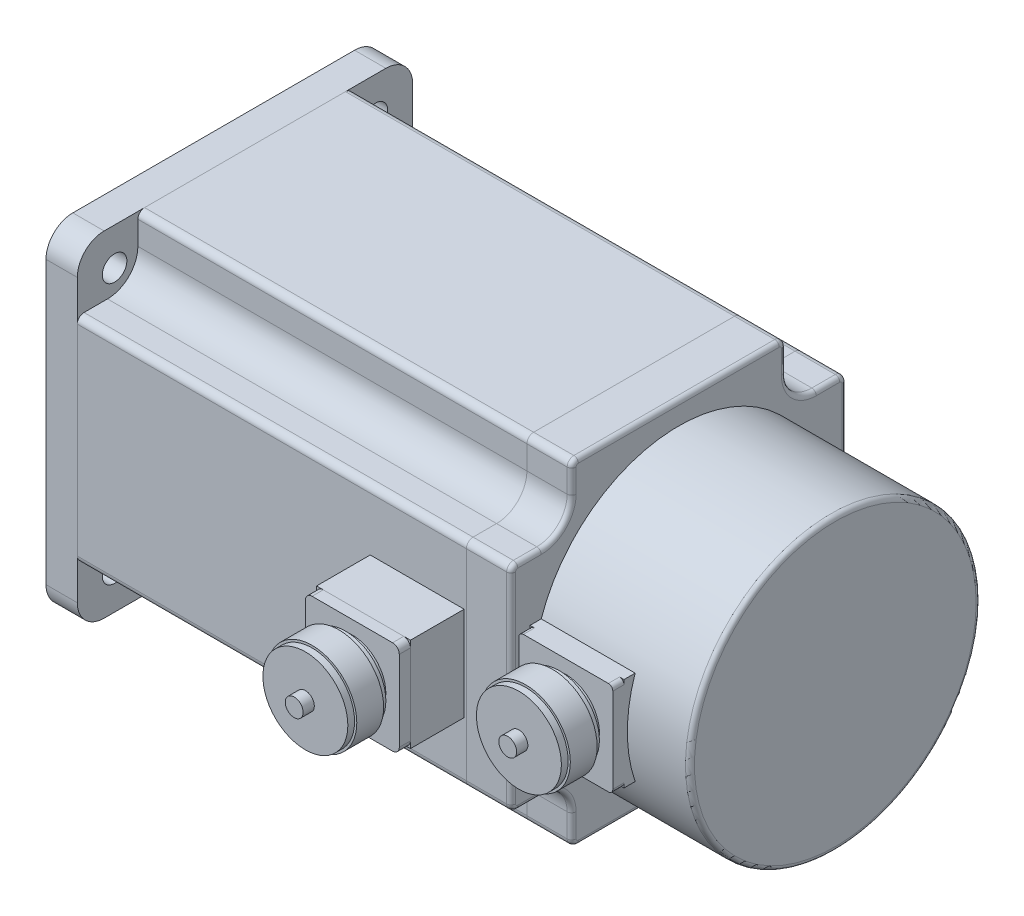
SolidWorks part; units mm, degrees
ref_plane "前视基准面" through (0, 0, 0) normal (0, 0, 1) x (1, 0, 0)
ref_plane "上视基准面" through (0, 0, 0) normal (0, 1, 0) x (1, 0, 0)
ref_plane "右视基准面" through (0, 0, 0) normal (1, 0, 0) x (0, 0, -1)
sketch "草图1" plane through (0, 0, 0) normal (1, 0, 0) x (0, 0, -1)
  line L1 (-63, -75) -> (63, -75)
  line L2 (-75, -63) -> (-75, 63)
  line L3 (-63, 75) -> (63, 75)
  line L4 (75, -63) -> (75, 63)
  line L5 (-75, -75) -> (75, 75) construction
  line L6 (-75, 75) -> (75, -75) construction
  arc A0 (63, -75) -> (75, -63) centre (63, -63) ccw
  arc A1 (-63, -75) -> (-75, -63) centre (-63, -63) cw
  arc A2 (-75, 63) -> (-63, 75) centre (-63, 63) cw
  arc A3 (63, 75) -> (75, 63) centre (63, 63) cw
  point P0 (0, 0)
  dimension "D1" = 12
extrude "凸台-拉伸1" add sketch "草图1" along normal blind 20
sketch "草图2" plane through (0, 0, 0) normal (-1, 0, 0) x (0, 0, 1)
  line L0 (-63, 75) -> (63, 75) construction
  line L1 (-63, -75) -> (63, -75)
  line L2 (-75, -63) -> (-75, 63)
  line L3 (-63, 75) -> (63, 75)
  line L4 (75, -63) -> (75, 63)
  line L5 (-75, -75) -> (75, 75) construction
  line L6 (-75, 75) -> (75, -75) construction
  arc A0 (63, 75) -> (75, 63) centre (63, 63) cw
  arc A1 (63, -75) -> (75, -63) centre (63, -63) ccw
  arc A2 (-63, -75) -> (-75, -63) centre (-63, -63) cw
  arc A3 (-75, 63) -> (-63, 75) centre (-63, 63) cw
  point P0 (0, 0)
  dimension "D1" = 12
extrude "凸台-拉伸2" add sketch "草图2" along normal blind 174 separate body
sketch "草图3" plane through (-174, 0, 0) normal (-1, 0, 0) x (0, 0, 1)
  line L0 (63, 75) -> (-63, 75) construction
  line L1 (-63, -75) -> (63, -75)
  line L2 (-75, -63) -> (-75, 63)
  line L3 (-63, 75) -> (63, 75)
  line L4 (75, -63) -> (75, 63)
  line L5 (-75, -75) -> (75, 75) construction
  line L6 (-75, 75) -> (75, -75) construction
  arc A0 (-63, -75) -> (-75, -63) centre (-63, -63) cw
  arc A1 (63, -75) -> (75, -63) centre (63, -63) ccw
  arc A2 (63, 75) -> (75, 63) centre (63, 63) cw
  arc A3 (-75, 63) -> (-63, 75) centre (-63, 63) cw
  point P0 (0, 0)
  dimension "D1" = 12
extrude "凸台-拉伸3" add sketch "草图3" along normal blind 14 separate body
sketch "草图4" plane through (0, 0, 75) normal (0, 0, 1) x (1, 0, 0)
  line L2 (-43, -21) -> (-1, -21)
  line L3 (-43, -21) -> (-43, 21)
  line L4 (-43, 21) -> (-1, 21)
  line L5 (-1, -21) -> (-1, 21)
  line L6 (-43, -21) -> (-1, 21) construction
  line L7 (-43, 21) -> (-1, -21) construction
extrude "凸台-拉伸4" add sketch "草图4" along normal blind 24 separate body
sketch "草图5" plane through (0, 0, 99) normal (0, 0, 1) x (1, 0, 0)
  line L0 (-1, 21) -> (-43, 21) construction
  line L1 (-40, -21) -> (-4, -21)
  line L2 (-43, -18) -> (-43, 18)
  line L3 (-40, 21) -> (-4, 21)
  line L4 (-1, -18) -> (-1, 18)
  line L5 (-43, -21) -> (-1, 21) construction
  line L6 (-43, 21) -> (-1, -21) construction
  arc A0 (-40, -21) -> (-43, -18) centre (-40, -18) cw
  arc A1 (-4, -21) -> (-1, -18) centre (-4, -18) ccw
  arc A2 (-4, 21) -> (-1, 18) centre (-4, 18) cw
  arc A3 (-43, 18) -> (-40, 21) centre (-40, 18) cw
  point P0 (-22, 0)
  dimension "D1" = 3
extrude "凸台-拉伸5" add sketch "草图5" along normal blind 5 separate body
sketch "草图6" plane through (0, 0, 104) normal (0, 0, 1) x (1, 0, 0)
  circle A0 centre (-22, 0) radius 15
extrude "凸台-拉伸6" add sketch "草图6" along normal blind 3 separate body
sketch "草图7" plane through (0, 0, 107) normal (0, 0, 1) x (1, 0, 0)
  circle A0 centre (-22, 0) radius 18
extrude "凸台-拉伸7" add sketch "草图7" along normal blind 3 separate body
sketch "草图8" plane through (0, 0, 110) normal (0, 0, 1) x (1, 0, 0)
  circle A0 centre (-22, 0) radius 20
extrude "凸台-拉伸8" add sketch "草图8" along normal blind 12 separate body
sketch "草图9" plane through (0, 0, 122) normal (0, 0, 1) x (1, 0, 0)
  circle A0 centre (-22, 0) radius 19
extrude "凸台-拉伸9" add sketch "草图9" along normal blind 3
sketch "草图10" plane through (0, 0, 125) normal (0, 0, 1) x (1, 0, 0)
  circle A0 centre (-22, 0) radius 4
extrude "凸台-拉伸10" add sketch "草图10" along normal blind 5
sketch "草图11" plane through (20, 0, 0) normal (1, 0, 0) x (0, 0, -1)
  line L0 (47.9169, -61.5) -> (47.9169, -72)
  line L1 (-75, -44.9169) -> (-75, -63)
  line L2 (-63, -75) -> (-44.9169, -75)
  line L3 (44.9169, -75) -> (63, -75)
  line L4 (75, -63) -> (75, -44.9169)
  line L6 (75, 63) -> (75, 44.9169)
  line L7 (-63, -75) -> (63, -75) construction
  line L8 (63, 75) -> (44.9169, 75)
  line L9 (-47.9169, -72) -> (-47.9169, -61.5)
  line L10 (-44.9169, 75) -> (-63, 75)
  line L11 (-61.5, -47.9169) -> (-72, -47.9169)
  line L12 (75, -63) -> (75, 63) construction
  line L13 (-75, 63) -> (-75, 44.9169)
  line L14 (-72, 47.9169) -> (-61.5, 47.9169)
  line L16 (-47.9169, 61.5) -> (-47.9169, 72)
  line L17 (63, 75) -> (-63, 75) construction
  line L19 (47.9169, 72) -> (47.9169, 61.5)
  line L21 (61.5, 47.9169) -> (72, 47.9169)
  line L22 (-75, 63) -> (-75, -63) construction
  line L24 (72, -47.9169) -> (61.5, -47.9169)
  arc A0 (-61.5, 47.9169) -> (-47.9169, 61.5) centre (-61.5, 61.5) ccw
  arc A1 (47.9169, 61.5) -> (61.5, 47.9169) centre (61.5, 61.5) ccw
  arc A2 (-47.9169, -61.5) -> (-61.5, -47.9169) centre (-61.5, -61.5) ccw
  arc A3 (-72, -47.9169) -> (-75, -44.9169) centre (-72, -44.9169) cw
  arc A4 (61.5, -47.9169) -> (47.9169, -61.5) centre (61.5, -61.5) ccw
  arc A5 (-75, 44.9169) -> (-72, 47.9169) centre (-72, 44.9169) cw
  arc A6 (-47.9169, 72) -> (-44.9169, 75) centre (-44.9169, 72) cw
  arc A7 (44.9169, 75) -> (47.9169, 72) centre (44.9169, 72) cw
  arc A8 (72, 47.9169) -> (75, 44.9169) centre (72, 44.9169) cw
  arc A9 (75, -44.9169) -> (72, -47.9169) centre (72, -44.9169) cw
  arc A10 (47.9169, -72) -> (44.9169, -75) centre (44.9169, -72) cw
  arc A11 (-44.9169, -75) -> (-47.9169, -72) centre (-44.9169, -72) cw
  arc A12 (-63, 75) -> (-75, 63) centre (-63, 63) ccw
  arc A13 (75, 63) -> (63, 75) centre (63, 63) ccw
  arc A14 (63, -75) -> (75, -63) centre (63, -63) ccw
  arc A15 (-75, -63) -> (-63, -75) centre (-63, -63) ccw
  point P0 (0, 0)
  point P1 (0, 0)
  point P12 (-75, -47.9169)
  point P43 (-75, 47.9169)
  point P47 (-47.9169, 75)
  point P48 (51.9891, -75)
  point P52 (47.9169, 75)
  point P56 (75, 47.9169)
  point P65 (75, -47.9169)
  point P82 (-47.9169, -75)
  dimension "D1" = 3
extrude "切除-拉伸2" cut sketch "草图11" against normal blind 194
fillet "圆角1" radius 2 24 edges at (20, 75, 0) (20, 0, -75) (20, -75, 0) (20, 0, 75) (20, 47.0382, 74.1213) (20, 47.9169, 66.75) (20, 51.8953, 51.8953) (20, 66.75, 47.9169) (20, 74.1213, 47.0382) (20, 74.1213, -47.0382) (20, 66.75, -47.9169) (20, 51.8953, -51.8953) (20, 47.9169, -66.75) (20, 47.0382, -74.1213) (20, -47.0382, -74.1213) (20, -47.9169, -66.75) (20, -51.8953, -51.8953) (20, -66.75, -47.9169) (20, -74.1213, -47.0382) (20, -74.1213, 47.0382) (20, -66.75, 47.9169) (20, -51.8953, 51.8953) (20, -47.9169, 66.75) (20, -47.0382, 74.1213)
sketch "草图12" plane through (-188, 0, 0) normal (-1, 0, 0) x (0, 0, 1)
  circle A2 centre (-58.3363, 58.3363) radius 5.5
  circle A3 centre (58.3363, 58.3363) radius 5.5
  circle A4 centre (58.3363, -58.3363) radius 5.5
  circle A5 centre (-58.3363, -58.3363) radius 5.5
extrude "切除-拉伸3" cut sketch "草图12" against normal blind 14
sketch "草图13" plane through (-188, 0, 0) normal (-1, 0, 0) x (0, 0, 1)
  circle A0 centre (0, 0) radius 65
  circle A1 centre (0, 0) radius 57.5
extrude "凸台-拉伸11" add sketch "草图13" along normal blind 5 separate body
sketch "草图14" plane through (-188, 0, 0) normal (-1, 0, 0) x (0, 0, 1)
  circle A0 centre (0, 0) radius 35
extrude "凸台-拉伸12" add sketch "草图14" along normal blind 5
sketch "草图15" plane through (-193, 0, 0) normal (-1, 0, 0) x (0, 0, 1)
  circle A0 centre (0, 0) radius 17.5
extrude "凸台-拉伸13" add sketch "草图15" along normal blind 0.5 separate body
fillet "圆角2" radius 0.5 1 edges at (-193.5, 0, 17.5)
sketch "草图16" plane through (-193.5, 0, 0) normal (-1, 0, 0) x (0, 0, 1)
  circle A0 centre (0, 0) radius 14
extrude "凸台-拉伸14" add sketch "草图16" along normal blind 52.5
chamfer "倒角1" distance 0.5 angle 45 1 edges at (-246, 0, 14)
ref_plane "基准面1" through (0, -14, 0) normal (0, 1, 0) x (1, 0, 0)
sketch "草图19" plane through (20, 0, 0) normal (1, 0, 0) x (0, 0, -1)
  circle A0 centre (0, 0) radius 65
extrude "凸台-拉伸16" add sketch "草图19" along normal blind 70 separate body
fillet "圆角3" radius 2 1 edges at (90, 0, -65)
ref_plane "基准面2" through (0, 0, 65) normal (0, 0, 1) x (1, 0, 0)
sketch "草图20" plane through (0, 0, 65) normal (0, 0, 1) x (1, 0, 0)
  line L1 (20, 65) -> (20, -65) construction
  line L3 (62, -21) -> (20, -21)
  line L4 (62, -21) -> (62, 21)
  line L5 (62, 21) -> (20, 21)
  line L6 (20, -21) -> (20, 21)
  line L7 (62, -21) -> (20, 21) construction
  line L8 (62, 21) -> (20, -21) construction
extrude "切除-拉伸5" cut sketch "草图20" against normal blind 10
sketch "草图21" plane through (0, 0, 55) normal (0, 0, 1) x (1, 0, 0)
  line L0 (62, 21) -> (20, 21) construction
  line L1 (20, -21) -> (62, -21)
  line L2 (20, -21) -> (20, 21)
  line L3 (20, 21) -> (62, 21)
  line L4 (62, -21) -> (62, 21)
  line L5 (20, -21) -> (62, 21) construction
  line L6 (20, 21) -> (62, -21) construction
  line L7 (20, 21) -> (62, 21) construction
  point P0 (41, 0)
extrude "凸台-拉伸17" add sketch "草图21" along normal blind 11.5
sketch "草图22" plane through (0, 0, 66.5) normal (0, 0, 1) x (1, 0, 0)
  line L0 (62, -21) -> (62, 21) construction
  line L1 (22, -21) -> (60, -21)
  line L2 (20, -19) -> (20, 19)
  line L3 (22, 21) -> (60, 21)
  line L4 (62, -19) -> (62, 19)
  line L5 (20, -21) -> (62, 21) construction
  line L6 (20, 21) -> (62, -21) construction
  line L7 (20, 21) -> (62, 21) construction
  arc A0 (22, -21) -> (20, -19) centre (22, -19) cw
  arc A1 (60, -21) -> (62, -19) centre (60, -19) ccw
  arc A2 (60, 21) -> (62, 19) centre (60, 19) cw
  arc A3 (20, 19) -> (22, 21) centre (22, 19) cw
  point P0 (41, 0)
  dimension "D1" = 2
extrude "凸台-拉伸18" add sketch "草图22" along normal blind 5 separate body
sketch "草图23" plane through (0, 0, 71.5) normal (0, 0, 1) x (1, 0, 0)
  circle A0 centre (41, 0) radius 15
extrude "凸台-拉伸19" add sketch "草图23" along normal blind 3
sketch "草图24" plane through (0, 0, 74.5) normal (0, 0, 1) x (1, 0, 0)
  circle A0 centre (41, 0) radius 18
extrude "凸台-拉伸20" add sketch "草图24" along normal blind 3
sketch "草图25" plane through (0, 0, 77.5) normal (0, 0, 1) x (1, 0, 0)
  circle A0 centre (41, 0) radius 20
extrude "凸台-拉伸21" add sketch "草图25" along normal blind 12
sketch "草图26" plane through (0, 0, 89.5) normal (0, 0, 1) x (1, 0, 0)
  circle A0 centre (41, 0) radius 19
extrude "凸台-拉伸22" add sketch "草图26" along normal blind 3
sketch "草图27" plane through (0, 0, 92.5) normal (0, 0, 1) x (1, 0, 0)
  circle A0 centre (41, 0) radius 4
extrude "凸台-拉伸23" add sketch "草图27" along normal blind 5
sketch "草图29" plane through (0, -14, 0) normal (0, 1, 0) x (1, 0, 0)
  line L3 (-238, -4) -> (-201, -4)
  line L5 (-201, 4) -> (-238, 4)
  arc A0 (-238, 4) -> (-238, -4) centre (-238, 0) ccw
  arc A1 (-201, -4) -> (-201, 4) centre (-201, 0) ccw
extrude "切除-拉伸7" cut sketch "草图29" along normal blind 5
sketch "草图30" plane through (0, -9, 0) normal (0, -1, 0) x (-1, 0, 0)
  line L0 (238, -4) -> (201, -4)
  line L2 (201, 4) -> (238, 4)
  arc A0 (238, -4) -> (238, 4) centre (238, 0) ccw
  arc A1 (201, 4) -> (201, -4) centre (201, 0) ccw
extrude "凸台-拉伸24" add sketch "草图30" along normal blind 8 separate body
